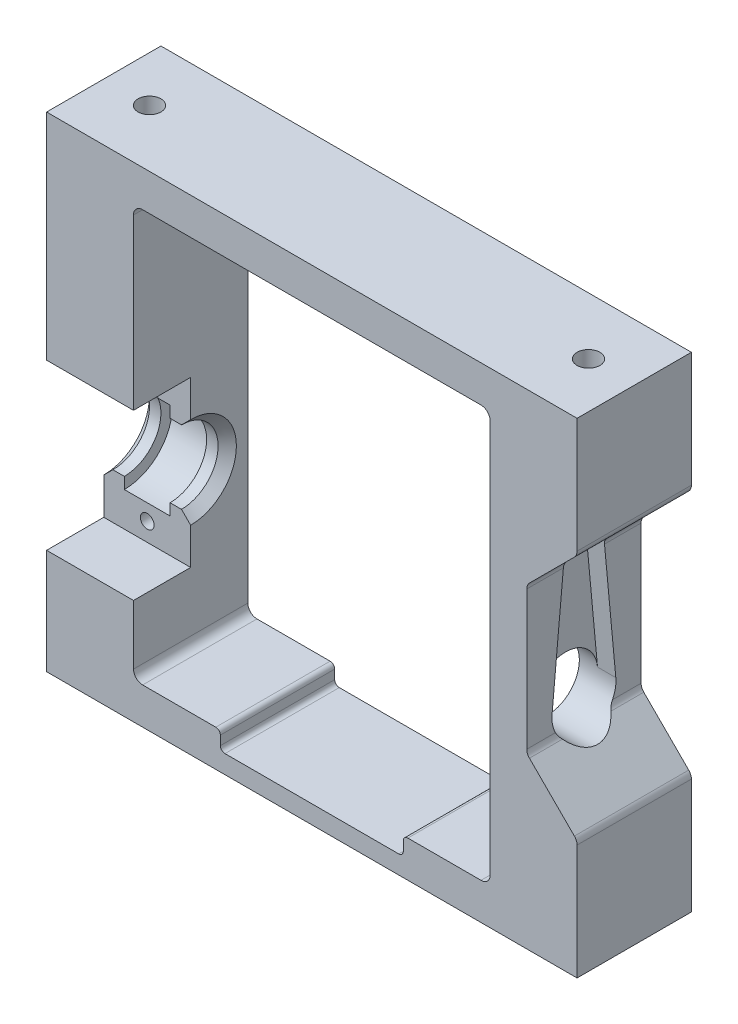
SolidWorks part; units mm, degrees
ref_plane "Спереди" through (0, 0, 0) normal (0, 0, 1) x (1, 0, 0)
ref_plane "Сверху" through (0, 0, 0) normal (0, 1, 0) x (1, 0, 0)
ref_plane "Справа" through (0, 0, 0) normal (1, 0, 0) x (0, 0, -1)
sketch "Эскиз1" plane through (0, 0, 0) normal (0, 0, 1) x (1, 0, 0)
  line L1 (-29, -26.5) -> (29, -26.5)
  line L2 (-29, -26.5) -> (-29, 26.5)
  line L3 (-29, 26.5) -> (29, 26.5)
  line L4 (29, -26.5) -> (29, 26.5)
  line L5 (-29, -26.5) -> (29, 26.5) construction
  line L6 (-29, 26.5) -> (29, -26.5) construction
  point P0 (0, 0)
  dimension "D1" = 58
  dimension "D2" = 53
extrude "тело" add sketch "Эскиз1" along normal blind 12.5
sketch "Эскиз3" plane through (0, 0, 12.5) normal (0, 0, 1) x (1, 0, 0)
  line L1 (-19.5, -22.5) -> (19.5, -22.5)
  line L2 (-19.5, -22.5) -> (-19.5, 22.5)
  line L3 (-19.5, 22.5) -> (19.5, 22.5)
  line L4 (19.5, -22.5) -> (19.5, 22.5)
  line L5 (-19.5, -22.5) -> (19.5, 22.5) construction
  line L6 (-19.5, 22.5) -> (19.5, -22.5) construction
  point P0 (0, 0)
  dimension "D1" = 39
  dimension "D2" = 45
extrude "отверстие под серво" cut sketch "Эскиз3" against normal through all
sketch "Эскиз11" plane through (0, -26.5, 0) normal (0, -1, 0) x (1, 0, 0)
  line L0 (0, 12.5) -> (0, 0) construction
  line L1 (-29, 12.5) -> (29, 12.5) construction
  line L2 (-24, 6.25) -> (24, 6.25) construction
  line L3 (-29, 12.5) -> (-29, 0) construction
  circle A0 centre (-24, 6.25) radius 1.25
  circle A1 centre (24, 6.25) radius 1.25
  point P8 (0, 6.25)
  dimension "D1" = 2.5
  dimension "D2" = 48
  dimension "D3" = 5
extrude "крепежные отверстия" cut sketch "Эскиз11" against normal blind 10
mirror "крепежные отверстия сверху" about plane through (0, 0, 0) normal (0, 1, 0) of "крепежные отверстия"
sketch "Эскиз4" plane through (29, 0, 0) normal (1, 0, 0) x (0, 0, -1)
  line L0 (-6.25, 26.5) -> (-6.25, -26.5) construction
  line L1 (-12.5, 26.5) -> (0, 26.5) construction
  line L2 (-12.5, -26.5) -> (0, -26.5) construction
  line L4 (-12.5, -26.5) -> (-12.5, 26.5) construction
  line L5 (-12.5, 0) -> (0, 0) construction
  line L6 (0, -26.5) -> (0, 26.5) construction
  circle A0 centre (-6.25, -6) radius 3.5
  dimension "D1" = 7
  dimension "D2" = 6
extrude "вырез под ось вращения" cut sketch "Эскиз4" against normal through all
sketch "Эскиз5" plane through (29, 0, 0) normal (1, 0, 0) x (0, 0, -1)
  line L0 (-6.25, 8) -> (-6.25, -6) construction
  line L1 (-9.7349, -5.675) -> (-8.4405, 8.2043)
  line L3 (-4.0595, 8.2043) -> (-2.7651, -5.675)
  arc A0 (-4.0595, 8.2043) -> (-8.4405, 8.2043) centre (-6.25, 8) ccw
  arc A1 (-9.7349, -5.675) -> (-2.7651, -5.675) centre (-6.25, -6) ccw
  circle A2 centre (-6.25, -6) radius 3.5 construction
  dimension "D1" = 4.4
  dimension "D2" = 14
extrude "вырез под качалку" cut sketch "Эскиз5" against normal offset from surface (7.5 mm away) 2
sketch "Эскиз6" plane through (-29, 0, 0) normal (-1, 0, 0) x (0, 0, 1)
  circle A0 centre (6.25, -6) radius 4
  dimension "D1" = 8
extrude "вырез под ось подшипника" cut sketch "Эскиз6" against normal up to surface (9.5 mm away)
sketch "Эскиз7" plane through (-29, 0, 0) normal (-1, 0, 0) x (0, 0, 1)
  line L0 (12.5, 26.5) -> (12.5, -26.5) construction
  line L1 (6.25, 3) -> (12.5, 3)
  line L2 (6.25, 3) -> (6.25, -15)
  line L3 (6.25, -15) -> (12.5, -15)
  line L4 (12.5, 3) -> (12.5, -15)
  point P6 (6.25, -6)
  point P7 (6.25, -6)
  dimension "D1" = 18
extrude "вырез под крепление подшипника" cut sketch "Эскиз7" against normal up to surface (9.5 mm away)
ref_plane "Плоскость1" through (-24.25, 0, 0) normal (-1, 0, 0) x (0, 0, 1)
sketch "Эскиз8" plane through (-24.25, 0, 0) normal (-1, 0, 0) x (0, 0, 1)
  circle A0 centre (6.25, -6) radius 5.25
  dimension "D1" = 10.5
extrude "вырез под подшипник" cut sketch "Эскиз8" against normal blind 2.5 and the other way blind 2.5
sketch "Эскиз9" plane through (0, 0, 6.25) normal (0, 0, 1) x (1, 0, 0)
  line L1 (-29, -6) -> (-19.5, -6) construction
  line L3 (-29, -2) -> (-29, -10) construction
  line L4 (-19.5, -10) -> (-19.5, -2) construction
  line L5 (-24.25, -13) -> (-24.25, 1) construction
  circle A0 centre (-24.25, 1) radius 0.75
  circle A1 centre (-24.25, -13) radius 0.75
  point P9 (-24.25, -6)
  dimension "D1" = 1.5
  dimension "D2" = 14
extrude "отверстия под саморезы" cut sketch "Эскиз9" against normal through all
sketch "Эскиз10" plane through (0, 0, 12.5) normal (0, 0, 1) x (1, 0, 0)
  line L0 (29, 0) -> (19.5, 0) construction
  line L1 (29, -26.5) -> (29, 26.5) construction
  line L2 (19.5, -22.5) -> (19.5, 22.5) construction
  line L3 (29, -13.5) -> (29, 13.5)
  line L4 (23.5, -8) -> (23.5, 8)
  line L5 (29, 13.5) -> (23.5, 8)
  line L6 (23.5, -8) -> (29, -13.5)
  point P9 (29, 0)
  point P12 (23.5, 0)
  dimension "D1" = 45
  dimension "D2" = 4
  dimension "D3" = 16
extrude "вырез чтобы вставлять качалку" cut sketch "Эскиз10" against normal through all
chamfer "Фаска1" distance 1 angle 45 2 edges at (-29, -6, 2.25) (-19.5, -6, 2.25)
fillet "Скругление1" radius 1 10 edges at (29, -13.5, 6.25) (23.5, -8, 10.8111) (23.5, -8, 1.6889) (23.5, 8, 10.4798) (23.5, 8, 2.0202) (29, 13.5, 6.25) (19.5, -22.5, 6.25) (-19.5, -22.5, 6.25) (-19.5, 22.5, 6.25) (19.5, 22.5, 6.25)
sketch "Эскиз12" plane through (0, 0, 0) normal (0, 0, 1) x (1, 0, 0)
  line L0 (-18.5, -22.5) -> (18.5, -22.5) construction
  line L1 (-10, -22.5) -> (10, -22.5)
  line L2 (-10, -22.5) -> (-10, -24.5)
  line L3 (-10, -24.5) -> (10, -24.5)
  line L4 (10, -22.5) -> (10, -24.5)
  point P6 (0, -22.5)
  dimension "D1" = 20
  dimension "D2" = 2
extrude "вырез под шлейф" cut sketch "Эскиз12" along normal through all
fillet "Скругление2" radius 0.5 4 edges at (10, -24.5, 6.25) (10, -22.5, 6.25) (-10, -24.5, 6.25) (-10, -22.5, 6.25)
